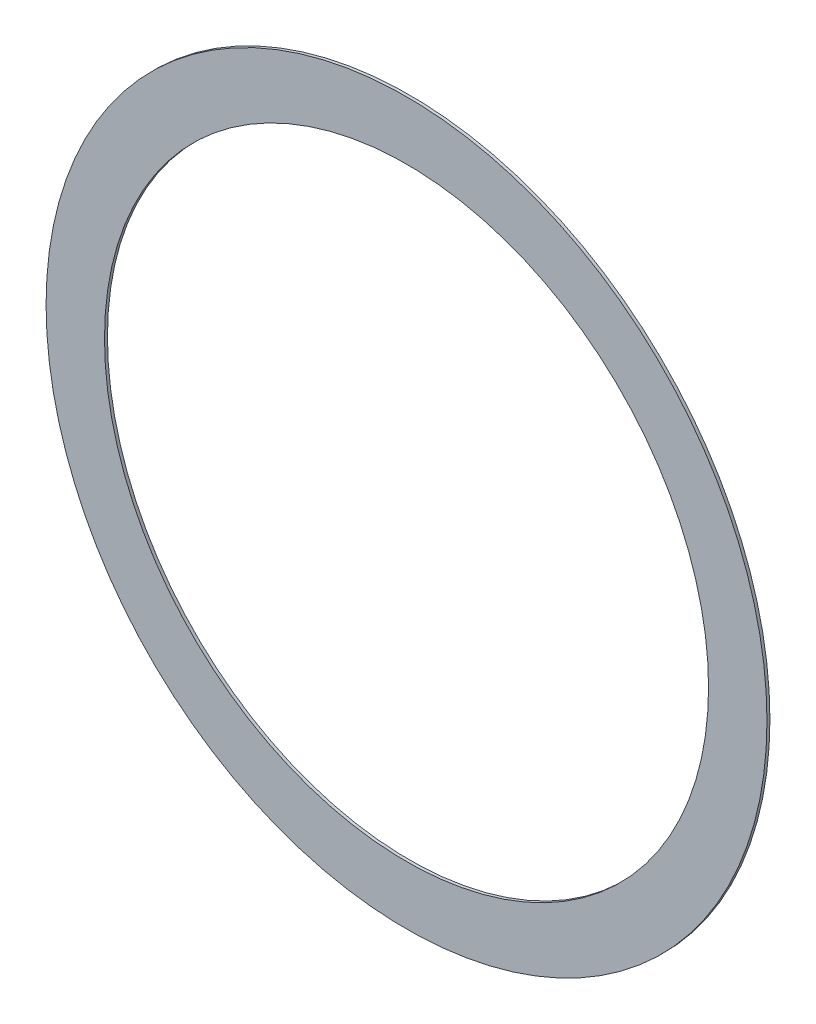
SolidWorks part; units mm, degrees
ref_plane "正面" through (0, 0, 0) normal (0, 0, 1) x (1, 0, 0)
ref_plane "平面" through (0, 0, 0) normal (0, 1, 0) x (1, 0, 0)
ref_plane "右側面" through (0, 0, 0) normal (1, 0, 0) x (0, 0, -1)
sketch "ｽｹｯﾁ1" plane through (0, 0, 0) normal (0, 0, 1) x (1, 0, 0)
  circle A0 centre (0, 0) radius 66.95
  circle A1 centre (0, 0) radius 56.1
  dimension "D1" = 112.2
  dimension "D2" = 133.9
extrude "ﾎﾞｽ - 押し出し1" add sketch "ｽｹｯﾁ1" along normal blind 0.55
